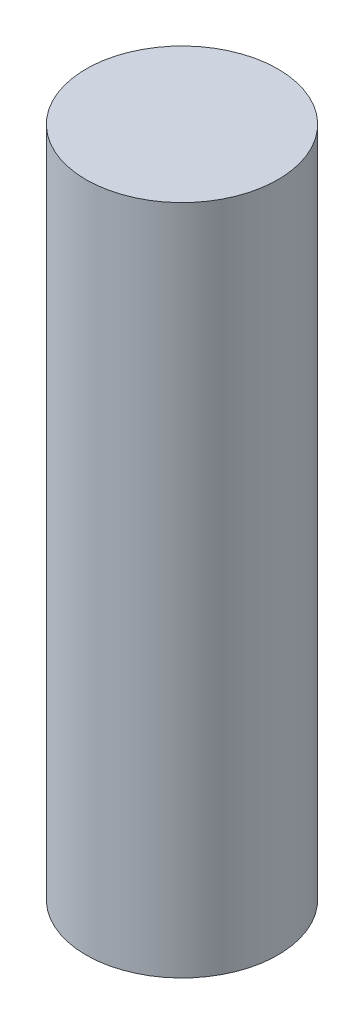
SolidWorks part; units mm, degrees
ref_plane "Front Plane" through (0, 0, 0) normal (0, 0, 1) x (1, 0, 0)
ref_plane "Top Plane" through (0, 0, 0) normal (0, 1, 0) x (1, 0, 0)
ref_plane "Right Plane" through (0, 0, 0) normal (1, 0, 0) x (0, 0, -1)
sketch "Sketch1" plane through (0, 0, 0) normal (0, 1, 0) x (1, 0, 0)
  circle A0 centre (0, 0) radius 8
  dimension "D1" = 16
extrude "Boss-Extrude1" add sketch "Sketch1" along normal blind 56
ref_plane "Plane1" through (0, 28, 0) normal (0, 1, 0) x (1, 0, 0)
